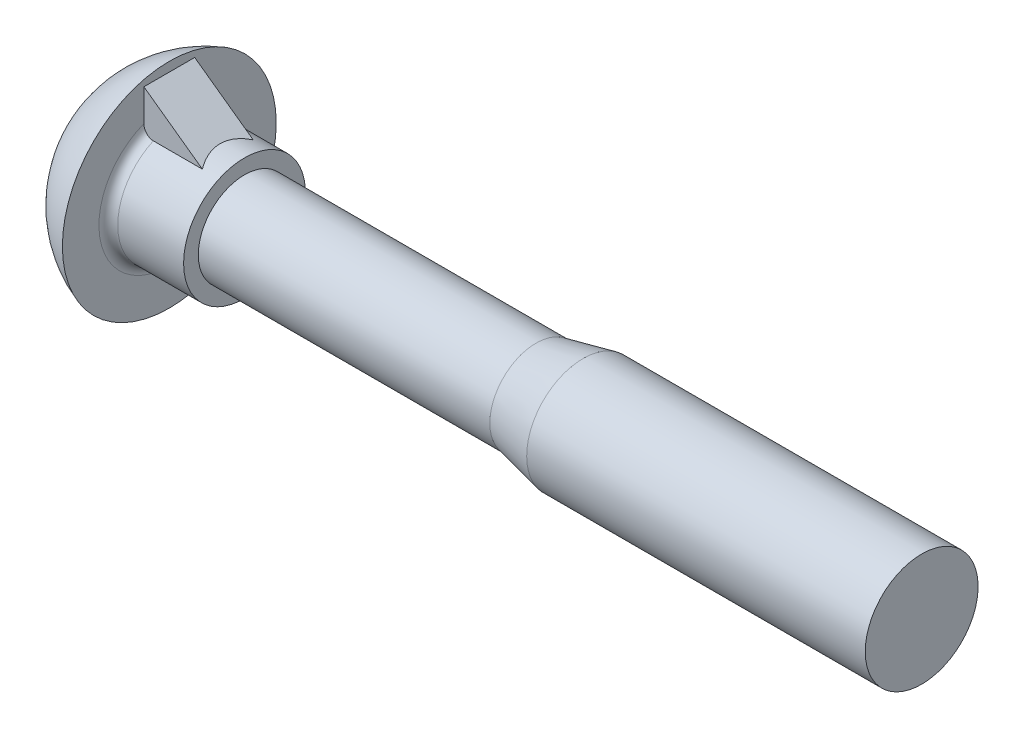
SolidWorks part; units mm, degrees
ref_plane "Front" through (0, 0, 0) normal (0, 0, 1) x (1, 0, 0)
ref_plane "Top" through (0, 0, 0) normal (0, 1, 0) x (1, 0, 0)
ref_plane "Right" through (0, 0, 0) normal (1, 0, 0) x (0, 0, -1)
sketch "Sketch1" plane through (0, 0, 0) normal (0, 0, 1) x (1, 0, 0)
  line L0 (-31.4843, 0) -> (43.5502, 0) construction
  line L1 (44.08, 0) -> (44.08, 3)
  line L2 (44.08, 3) -> (8.08, 3)
  line L3 (8.08, 3) -> (8.08, 3.24)
  line L4 (8.08, 3.24) -> (4.58, 3.24)
  line L5 (4.08, 3.74) -> (4.08, 5.6845)
  line L6 (44.08, 0) -> (0, 0)
  arc A0 (4.08, 5.6845) -> (0, 0) centre (6, 0) ccw
  arc A1 (4.58, 3.24) -> (4.08, 3.74) centre (4.58, 3.74) cw
  point P13 (4.08, 3.24)
  dimension "r" = 6
  dimension "rr" = 0.5
  dimension "d" = 6
  dimension "ds" = 6.48
  dimension "k" = 4.08
  dimension "h" = 4
  dimension "l" = 40
revolve "Base" add sketch "Sketch1" angle 360 about L0
sketch "Sketch2" plane through (0, 0, 0) normal (0, 0, 1) x (1, 0, 0)
  line L1 (6.78, 3.24) -> (4.08, 5.1845)
  line L2 (8.08, 3.24) -> (4.58, 3.24) construction
  line L3 (4.08, -5.6845) -> (4.08, 5.6845) construction
  line L4 (-31.4843, 0) -> (43.5502, 0) construction
  dimension "D2" = 5.1845
  dimension "h1" = 2.7
rib "Nib" sketch "Sketch2" sketch "Sketch2" thickness 2.7 extrusion direction parallel to sketch draft on no parameters "Sn"=2.7
sketch "Sketch3" plane through (0, 0, 0) normal (0, 0, 1) x (1, 0, 0)
  line L0 (26.08, 3) -> (23.58, 2.4585)
  line L1 (0, 0) -> (55.457, 0) construction
  line L2 (23.58, 2.4585) -> (8.08, 2.4585)
  line L3 (44.08, -3) -> (44.08, 3) construction
  line L4 (8.08, 2.4585) -> (8.08, 3)
  line L5 (8.08, 3) -> (26.08, 3)
  line L6 (-29.8163, 0) -> (1.1759, 0) construction
  dimension "D1" = 4.917
  dimension "x" = 2.5
  dimension "b" = 18
revolve "Cut-Revolve1" cut sketch "Sketch3" angle 360 about L6
sketch "Sketch4" plane through (0, 0, 0) normal (0, 0, 1) x (1, 0, 0)
  line L0 (43.8092, 3.2) -> (44.3507, 3.2)
  line L1 (44.3507, 3.2) -> (44.3507, 3)
  line L2 (44.3507, 3) -> (44.08, 2.531)
  line L3 (44.08, -3) -> (44.08, 3) construction
  line L5 (43.8092, 3) -> (44.08, 2.531)
  line L6 (43.8092, 3.2) -> (43.8092, 3)
  line L8 (44.08, 0) -> (39.6447, 0) construction
  line L9 (43.8092, 3) -> (44.3507, 3) construction
  line L10 (44.08, 3) -> (44.08, 2.531) construction
  point P10 (44.08, 3.2)
  dimension "D1" = 0.2
  dimension "D2" = 0.5415
  dimension "D3" = 6
revolve "Cut-Revolve10" [suppressed] cut sketch "Sketch4" angle 360 about L8
pattern_linear "LPattern10" [suppressed] count 55 spacing 0.6498 along (1, 0, 0)
equation "\"D2@Sketch2\" = sqr ( \"r@Sketch1\" * \"r@Sketch1\" -  ( \"r@Sketch1\" - \"k@Sketch1\" )  *  ( \"r@Sketch1\" - \"k@Sketch1\" )  ) -0.5"
equation "\"D2@Sketch4\" =  ( \"d@Sketch1\" - \"D2@ThreadCosmetic1\" )  / 2"
equation "\"D3@LPattern10\" = 1.2 * \"D2@Sketch4\" "
equation "\"D1@LPattern10\" =  ( \"l@Sketch1\" - \"h@Sketch1\" )  /  \"D3@LPattern10\""
equation "\"D1@Sketch3\" = \"D2@ThreadCosmetic1\""
equation "\"D3@Sketch4\" = \"d@Sketch1\""
